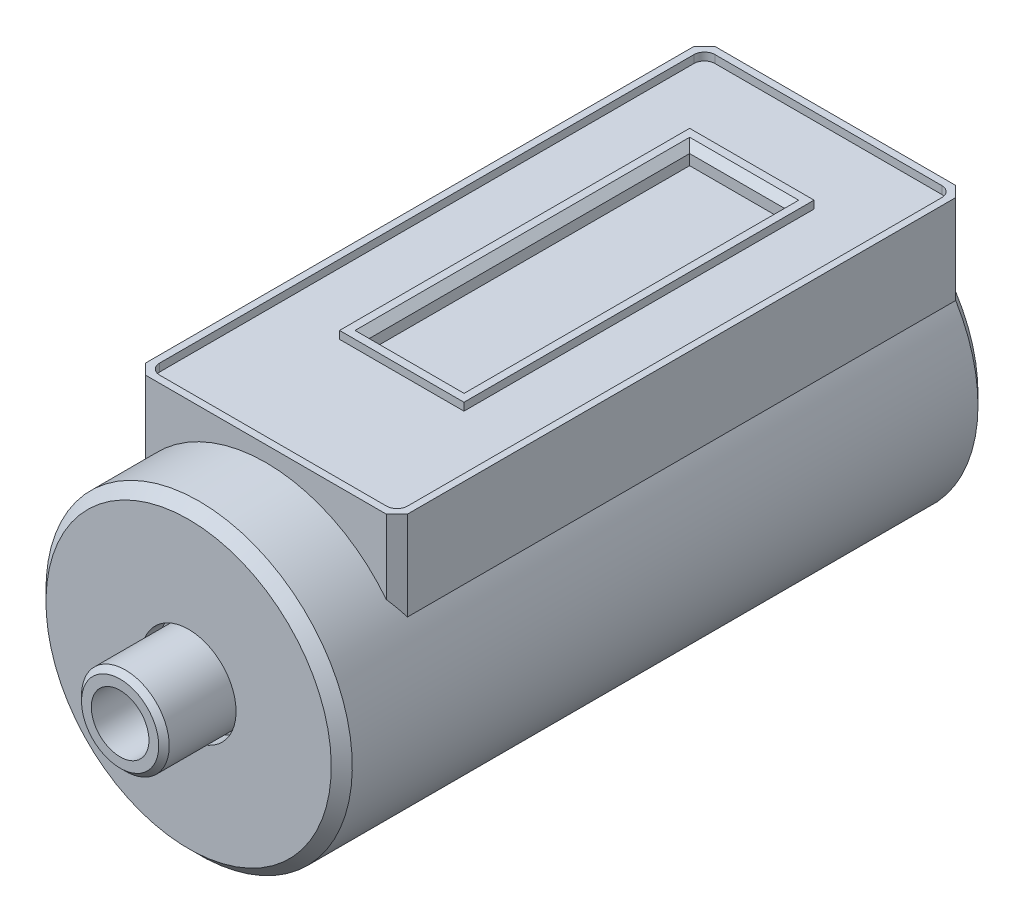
SolidWorks part; units mm, degrees
ref_plane "Front" through (0, 0, 0) normal (0, 0, 1) x (1, 0, 0)
ref_plane "Top" through (0, 0, 0) normal (0, 1, 0) x (1, 0, 0)
ref_plane "Right" through (0, 0, 0) normal (1, 0, 0) x (0, 0, -1)
sketch "Sketch2" plane through (0, 0, 0) normal (1, 0, 0) x (0, 0, -1)
  line L0 (46.735, 0) -> (46.735, 2.79)
  line L1 (47.115, 3.17) -> (52.955, 3.17)
  line L2 (51.685, 3.43) -> (51.685, 10.31)
  line L3 (52.445, 11.07) -> (98.425, 11.07)
  line L4 (98.425, 11.07) -> (98.425, 0)
  line L5 (98.425, 0) -> (46.735, 0)
  line L6 (51.685, 3.43) -> (52.955, 3.43)
  line L7 (52.955, 3.43) -> (52.955, 3.17)
  line L8 (46.735, 2.79) -> (47.115, 3.17)
  line L9 (51.685, 10.31) -> (52.445, 11.07)
  dimension "D1" = 51.69
  dimension "D2" = 3.17
  dimension "D3" = 11.07
  dimension "D4" = 4.95
  dimension "D5" = 1.27
  dimension "D6" = 3.43
  dimension "D7" = 2.79
  dimension "D8" = 0.38
  dimension "D9" = 0.76
  dimension "D10" = 10.31
  dimension "D11" = 98.425
revolve "Revolve1" add sketch "Sketch2" angle 360 about L5
sketch "Sketch3" plane through (0, 0, 0) normal (0, 1, 0) x (1, 0, 0)
  line L0 (11.07, 98.425) -> (-11.07, 98.425) construction
  line L1 (-9.46, 98.425) -> (9.46, 98.425)
  line L2 (-9.46, 98.425) -> (-9.46, 58.035)
  line L3 (-8.7, 57.275) -> (8.7, 57.275)
  line L4 (9.46, 98.425) -> (9.46, 58.035)
  line L5 (-9.46, 58.035) -> (-8.7, 57.275)
  line L6 (9.46, 58.035) -> (8.7, 57.275)
  point P1 (9.46, 57.275)
  point P2 (-9.46, 57.275)
  point P6 (0, 57.275)
  dimension "D1" = 41.15
  dimension "D2" = 18.92
extrude "Extrude1" add sketch "Sketch3" along normal blind 12.19
chamfer "Chamfer1" distance 0.76 angle 45 3 edges at (-9.46, 8.9696, -98.425) (0, -11.07, -98.425) (9.46, 8.9696, -98.425)
sketch "Sketch4" plane through (0, 12.19, 0) normal (0, 1, 0) x (1, 0, 0)
  line L0 (-8.7, 57.275) -> (8.7, 57.275) construction
  line L1 (-8.19, 97.915) -> (8.2, 97.915)
  line L2 (-8.95, 97.155) -> (-8.95, 58.545)
  line L3 (-8.19, 57.785) -> (8.2, 57.785)
  line L4 (8.96, 97.155) -> (8.96, 58.545)
  line L5 (-9.46, 58.035) -> (-9.46, 97.665) construction
  line L7 (-4.49, 92.385) -> (4.5, 92.385)
  line L8 (-4.49, 92.385) -> (-4.49, 67.085)
  line L9 (-4.49, 67.085) -> (4.5, 67.085)
  line L10 (4.5, 92.385) -> (4.5, 67.085)
  arc A0 (-8.95, 97.155) -> (-8.19, 97.915) centre (-8.19, 97.155) cw
  arc A1 (8.96, 97.155) -> (8.2, 97.915) centre (8.2, 97.155) ccw
  arc A2 (8.96, 58.545) -> (8.2, 57.785) centre (8.2, 58.545) cw
  arc A3 (-8.95, 58.545) -> (-8.19, 57.785) centre (-8.19, 58.545) ccw
  dimension "D5" = 0.76
  dimension "D1" = 17.91
  dimension "D2" = 40.13
  dimension "D3" = 0.51
  dimension "D4" = 0.51
  dimension "D6" = 5.53
  dimension "D7" = 4.46
  dimension "D8" = 4.46
  dimension "D9" = 25.3
extrude "Cut-Extrude1" cut sketch "Sketch4" against normal blind 0.56
sketch "Sketch5" plane through (0, 12.19, 0) normal (0, 1, 0) x (1, 0, 0)
  line L1 (-3.42, 91.315) -> (3.44, 91.315)
  line L2 (-3.42, 91.315) -> (-3.42, 68.155)
  line L3 (-3.42, 68.155) -> (3.44, 68.155)
  line L4 (3.44, 91.315) -> (3.44, 68.155)
  line L6 (4.5, 92.385) -> (-4.49, 92.385) construction
  line L7 (-4.49, 92.385) -> (-4.49, 67.085) construction
  point P4 (0.005, 92.385)
  dimension "D1" = 6.86
  dimension "D2" = 23.16
  dimension "D3" = 1.07
  dimension "D4" = 1.07
extrude "Cut-Extrude2" cut sketch "Sketch5" against normal blind 1.27
chamfer "Chamfer2" distance 0.51 angle 45 4 edges at (0.01, 12.19, -68.155) (3.44, 12.19, -79.735) (-3.42, 12.19, -79.735) (0.01, 12.19, -91.315)
hole_wizard "Hole1" positions "Sketch7" profile "Sketch6" legacy
sketch "Sketch7" plane through (0, 0, -46.735) normal (0, 0, 1) x (1, 0, 0)
  circle A0 centre (0, 0) radius 3.17 construction
  point P0 (0, 0)
sketch "Sketch6" plane through (0, 0, -46.735) normal (1, 0, 0) x (0, -1, 0)
  line L0 (0, 0) -> (0, 7.6015)
  line L1 (0, 7.6015) -> (2.0828, 6.35)
  line L2 (2.0828, 6.35) -> (2.0828, 0)
  line L4 (2.0828, 0) -> (0, 0)
  line L6 (0, 7.6015) -> (-2.0828, 6.35) construction
  line L7 (0, -4.2442) -> (0, 117.3081) construction
  dimension "Diameter" = 4.1656
  dimension "Depth" = 6.35
  dimension "Drill Angle" = 118
